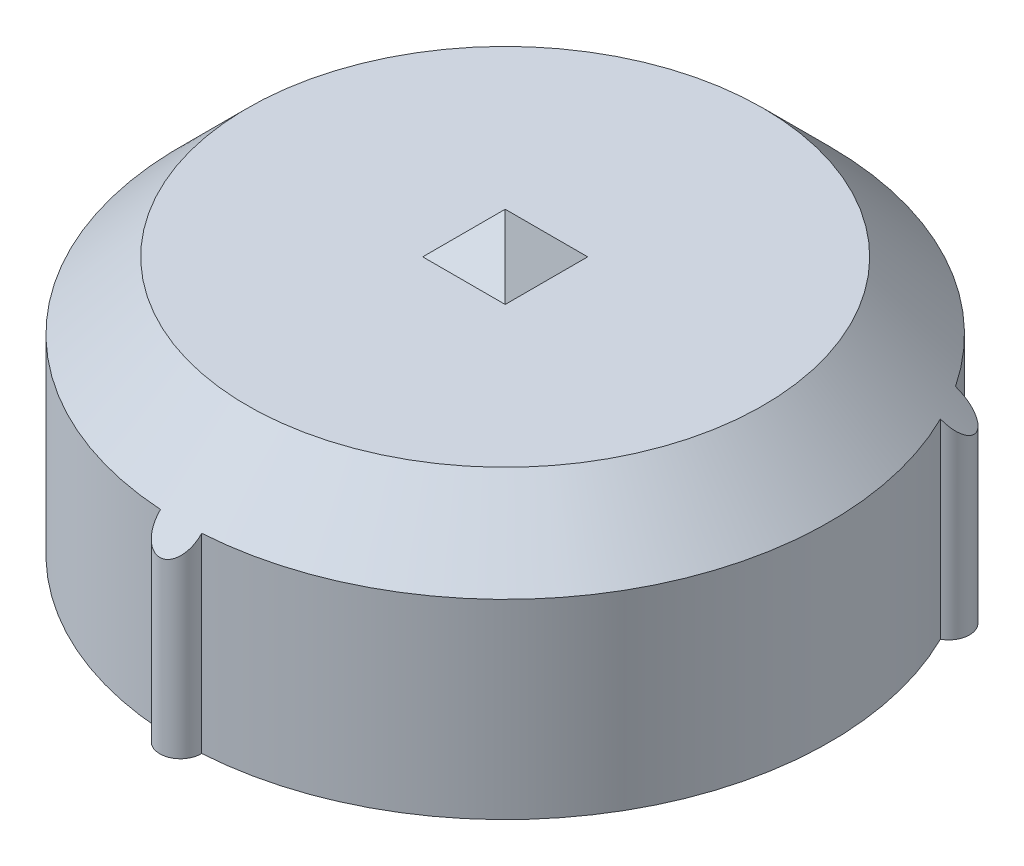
SolidWorks part; units mm, degrees
ref_plane "Front Plane" through (0, 0, 0) normal (0, 0, 1) x (1, 0, 0)
ref_plane "Top Plane" through (0, 0, 0) normal (0, 1, 0) x (1, 0, 0)
ref_plane "Right Plane" through (0, 0, 0) normal (1, 0, 0) x (0, 0, -1)
sketch "Sketch1" plane through (0, 0, 0) normal (0, 0, 1) x (1, 0, 0)
  line L0 (0, 0) -> (0, -66.2626) construction
  line L1 (0, 0) -> (6.7, 0)
  line L2 (6.7, 0) -> (6.7, 5)
  line L4 (6.7, 5) -> (0, 5)
  line L5 (0, 5) -> (0, 0)
  dimension "D1" = 5
  dimension "D2" = 13.4
revolve "Revolve1" add sketch "Sketch1" angle 360 about L0
sketch "Sketch2" plane through (0, 0, 0) normal (0, 1, 0) x (1, 0, 0)
  line L0 (0, 0) -> (0, -5.5148) construction
  line L1 (0, 0) -> (-5.4284, 3.1341) construction
  line L2 (0, 0) -> (5.592, 3.2286) construction
  arc A0 (0.3998, -6.2873) -> (5.6449, 2.7974) centre (0, 0) ccw
  circle A1 centre (0, 0) radius 7.2
  arc A3 (-0.3998, -6.2873) -> (0.3998, -6.2873) centre (0, -6.3) ccw
  arc A4 (-5.2451, 3.4899) -> (-5.6449, 2.7974) centre (-5.456, 3.15) ccw
  arc A5 (-5.6449, 2.7974) -> (-0.3998, -6.2873) centre (0, 0) ccw
  arc A6 (5.6449, 2.7974) -> (5.2451, 3.4899) centre (5.456, 3.15) ccw
  arc A7 (5.2451, 3.4899) -> (-5.2451, 3.4899) centre (0, 0) ccw
  circle A8 centre (0, 0) radius 6.7 construction
  dimension "D1" = 12.6
  dimension "D2" = 0.5
  dimension "D3" = 120
  dimension "D4" = 120
extrude "Extrude1" cut sketch "Sketch2" along normal through all
sketch "Sketch4" plane through (0, 0, 0) normal (0, 1, 0) x (1, 0, 0)
  line L0 (0, 0) -> (4.9919, 0) construction
  line L1 (0, 0) -> (3.8331, -3.8331) construction
  dimension "D1" = 45
ref_plane "Plane1" through (0, 0, 0) normal (0.7071, 0, 0.7071) x (0.7071, 0, -0.7071)
sketch "Sketch6" [suppressed] plane through (0, 0, 0) normal (1, 0, 0) x (0, 0, -1)
  line L0 (0, 0) -> (0, 4.8917) construction
  line L2 (-8.45, 1) -> (-8.45, 5)
  line L3 (-8.45, 5) -> (-4.45, 5)
  line L4 (-4.45, 5) -> (-8.45, 1)
  point P5 (-5.95, 3.5)
  dimension "D1" = 5
  dimension "D2" = 10
  dimension "D3" = 45
  dimension "D4" = 1
  dimension "D5" = 1
revolve "Cut-Revolve1" [suppressed] cut sketch "Sketch6" angle 360 about L0
sketch "Sketch5" [suppressed] plane through (0, 0, 0) normal (0, 0, 1) x (1, 0, 0)
  line L0 (1.5, 5) -> (0, 3.5)
  line L2 (0, 3.5) -> (-1.5, 5)
  line L3 (-1.5, 5) -> (1.5, 5)
  line L4 (0, 3.5) -> (0, 5) construction
  line L5 (-0.3998, 5) -> (-6.3, 5) construction
  dimension "D1" = 2
extrude "Extrude2" [suppressed] cut sketch "Sketch5" against normal through all and the other way through all
pattern_linear "LPattern1" [suppressed] count 8 spacing 2 along (1, 0, 0) count 8 spacing 2 along (1, 0, 0)
mirror "Mirror1" [suppressed] about plane through (0, 0, 0) normal (0.7071, 0, 0.7071)
sketch "Sketch7" plane through (0, 0, 0) normal (0, 1, 0) x (1, 0, 0)
  line L1 (-0.8, 0.8) -> (0.8, 0.8)
  line L2 (-0.8, 0.8) -> (-0.8, -0.8)
  line L3 (-0.8, -0.8) -> (0.8, -0.8)
  line L4 (0.8, 0.8) -> (0.8, -0.8)
  line L5 (-0.8, 0.8) -> (0.8, -0.8) construction
  line L6 (-0.8, -0.8) -> (0.8, 0.8) construction
  point P0 (0, 0)
  dimension "D1" = 1.6
extrude "Extrude3" add sketch "Sketch7" along normal blind 5.8
draft "Draft1" type of draft neutral plane draft angle 45 faces to draft 4 parameters "D1"=45
sketch "Sketch8" plane through (0, 0, 0) normal (0, 0, 1) x (1, 0, 0)
  line L0 (0, 0) -> (0, 4.8917) construction
  line L2 (-9, 1) -> (-9, 5)
  line L3 (-9, 5) -> (-5, 5)
  line L4 (-5, 5) -> (-9, 1)
  dimension "D1" = 5
  dimension "D2" = 10
  dimension "D3" = 45
  dimension "D4" = 1
revolve "Cut-Revolve3" cut sketch "Sketch8" angle 360 about L0
